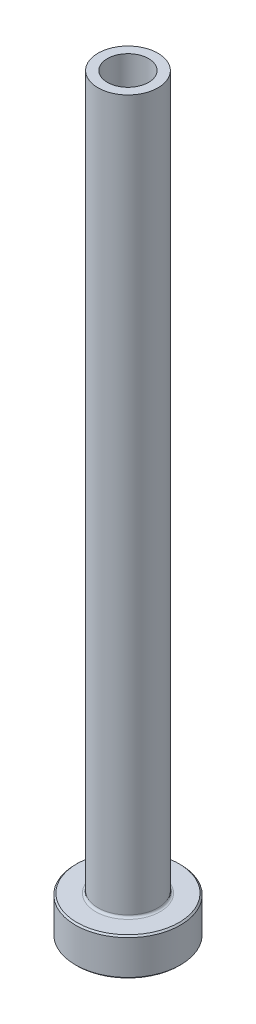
SolidWorks part; units mm, degrees
ref_plane "Front Plane" through (0, 0, 0) normal (0, 0, 1) x (1, 0, 0)
ref_plane "Top Plane" through (0, 0, 0) normal (0, 1, 0) x (1, 0, 0)
ref_plane "Right Plane" through (0, 0, 0) normal (1, 0, 0) x (0, 0, -1)
sketch "Sketch1" plane through (0, 0, 0) normal (0, 0, 1) x (1, 0, 0)
  line L0 (-2.75, 100) -> (-4, 100)
  line L1 (-4, 100) -> (-4, 5)
  line L2 (-4, 5) -> (-7, 5)
  line L3 (-7, 5) -> (-7, 0)
  line L4 (7.7, 0) -> (-7.7, 0) construction
  line L5 (-7, 0) -> (-3, 0)
  line L6 (-2.75, 55) -> (-2.75, 100)
  line L7 (0, 92.1877) -> (0, -15.5353) construction
  line L8 (0, -7.7) -> (0, 7.7) construction
  line L9 (-2.75, 55) -> (-3, 43)
  line L10 (-3, 43) -> (-3, 0)
  dimension "D1" = 0.25
  dimension "ID" = 5.5
  dimension "OD" = 8
  dimension "L" = 100
  dimension "H" = 14
  dimension "T" = 5
  dimension "N" = 45
  dimension "D2" = 12
revolve "Revolve1" add sketch "Sketch1" angle 360 about L7
fillet "Fillet1" radius 0.3 1 edges at (0, 5, 4)
chamfer "Chamfer1" distance 0.2 angle 45 2 edges at (0, 5, 7) (0, 0, 7)
chamfer "Chamfer3" distance 0.5 angle 45 1 edges at (0, 0, 3)
